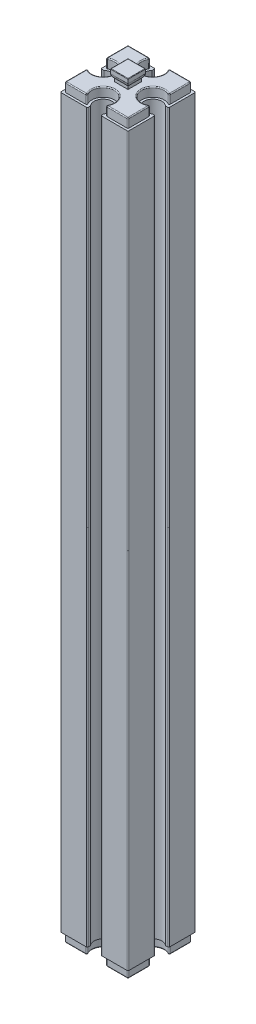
SolidWorks part; units mm, degrees
ref_plane "前视基准面" through (0, 0, 0) normal (0, 0, 1) x (1, 0, 0)
ref_plane "上视基准面" through (0, 0, 0) normal (0, 1, 0) x (1, 0, 0)
ref_plane "右视基准面" through (0, 0, 0) normal (1, 0, 0) x (0, 0, -1)
sketch "草图1" plane through (0, 0, 0) normal (0, 1, 0) x (1, 0, 0)
  line L0 (0, 0) -> (0, 7.5) construction
  line L1 (0, 0) -> (7.5, 0) construction
  line L2 (-7.5, 7.5) -> (-1.5, 7.5)
  line L3 (7.5, 7.5) -> (7.5, 1.5)
  line L4 (6.8229, 1.5) -> (7.5, 1.5)
  line L5 (6.8229, -1.5) -> (7.5, -1.5)
  line L6 (0, 7.5) -> (0, 5.5) construction
  line L7 (-1.5, 6.8229) -> (-1.5, 7.5)
  line L8 (1.5, 6.8229) -> (1.5, 7.5)
  line L9 (1.5, 7.5) -> (7.5, 7.5)
  line L10 (7.5, -1.5) -> (7.5, -7.5)
  line L11 (7.5, -7.5) -> (1.5, -7.5)
  line L12 (1.5, -6.8229) -> (1.5, -7.5)
  line L13 (-1.5, -6.8229) -> (-1.5, -7.5)
  line L14 (-1.5, -7.5) -> (-7.5, -7.5)
  line L15 (-7.5, -7.5) -> (-7.5, -1.5)
  line L16 (-6.8229, -1.5) -> (-7.5, -1.5)
  line L17 (-6.8229, 1.5) -> (-7.5, 1.5)
  line L18 (-7.5, 1.5) -> (-7.5, 7.5)
  arc A0 (-1.5, 6.8229) -> (1.5, 6.8229) centre (0, 5.5) ccw
  arc A1 (6.8229, 1.5) -> (6.8229, -1.5) centre (5.5, 0) ccw
  arc A2 (1.5, -6.8229) -> (-1.5, -6.8229) centre (0, -5.5) ccw
  arc A3 (-6.8229, -1.5) -> (-6.8229, 1.5) centre (-5.5, 0) ccw
  point P36 (0, 0)
  dimension "D6" = 4
  dimension "D7" = 2
  dimension "D1" = 7.5
  dimension "D2" = 7.5
  dimension "D3" = 2
  dimension "D4" = 7.5
  dimension "D5" = 1.5
extrude "凸台-拉伸1" add sketch "草图1" along normal blind 80.5
sketch "草图2" plane through (0, 80.5, 0) normal (0, 1, 0) x (1, 0, 0)
  line L0 (-7, 7) -> (-7, 2)
  line L1 (-7, 2) -> (-7, 2)
  line L2 (-7, -2) -> (-7, -2)
  line L3 (-7, -2) -> (-7, -7)
  line L4 (-7, -7) -> (-2, -7)
  line L5 (-2, -7) -> (-2, -7)
  line L6 (2, -7) -> (2, -7)
  line L7 (2, -7) -> (7, -7)
  line L8 (7, -7) -> (7, -2)
  line L9 (7, -2) -> (7, -2)
  line L10 (7, 2) -> (7, 2)
  line L11 (7, 2) -> (7, 7)
  line L12 (7, 7) -> (2, 7)
  line L13 (2, 7) -> (2, 7)
  line L14 (-2, 7) -> (-2, 7)
  line L15 (-2, 7) -> (-7, 7)
  line L16 (-7.5, 7.5) -> (-7.5, 1.5)
  line L17 (-7.5, 1.5) -> (-6.8229, 1.5)
  line L18 (-6.8229, -1.5) -> (-7.5, -1.5)
  line L19 (-7.5, -1.5) -> (-7.5, -7.5)
  line L20 (-7.5, -7.5) -> (-1.5, -7.5)
  line L21 (-1.5, -7.5) -> (-1.5, -6.8229)
  line L22 (1.5, -6.8229) -> (1.5, -7.5)
  line L23 (1.5, -7.5) -> (7.5, -7.5)
  line L24 (7.5, -7.5) -> (7.5, -1.5)
  line L25 (7.5, -1.5) -> (6.8229, -1.5)
  line L26 (6.8229, 1.5) -> (7.5, 1.5)
  line L27 (7.5, 1.5) -> (7.5, 7.5)
  line L28 (7.5, 7.5) -> (1.5, 7.5)
  line L29 (1.5, 7.5) -> (1.5, 6.8229)
  line L30 (-1.5, 6.8229) -> (-1.5, 7.5)
  line L31 (-1.5, 7.5) -> (-7.5, 7.5)
  line L32 (-7.5, 7.5) -> (-7.5, 1.5) construction
  line L33 (-7.5, 1.5) -> (-6.8229, 1.5) construction
  line L34 (-6.8229, -1.5) -> (-7.5, -1.5) construction
  line L35 (-7.5, -1.5) -> (-7.5, -7.5) construction
  line L36 (-7.5, -7.5) -> (-1.5, -7.5) construction
  line L37 (-1.5, -7.5) -> (-1.5, -6.8229) construction
  line L38 (1.5, -6.8229) -> (1.5, -7.5) construction
  line L39 (1.5, -7.5) -> (7.5, -7.5) construction
  line L40 (7.5, -7.5) -> (7.5, -1.5) construction
  line L41 (7.5, -1.5) -> (6.8229, -1.5) construction
  line L42 (6.8229, 1.5) -> (7.5, 1.5) construction
  line L43 (7.5, 1.5) -> (7.5, 7.5) construction
  line L44 (7.5, 7.5) -> (1.5, 7.5) construction
  line L45 (1.5, 7.5) -> (1.5, 6.8229) construction
  line L46 (-1.5, 6.8229) -> (-1.5, 7.5) construction
  line L47 (-1.5, 7.5) -> (-7.5, 7.5) construction
  arc A0 (-7, -2) -> (-7, 2) centre (-5.5, 0) ccw
  arc A1 (2, -7) -> (-2, -7) centre (0, -5.5) ccw
  arc A2 (7, 2) -> (7, -2) centre (5.5, 0) ccw
  arc A3 (-2, 7) -> (2, 7) centre (0, 5.5) ccw
  arc A4 (-6.8229, -1.5) -> (-6.8229, 1.5) centre (-5.5, 0) ccw
  arc A5 (1.5, -6.8229) -> (-1.5, -6.8229) centre (0, -5.5) ccw
  arc A6 (6.8229, 1.5) -> (6.8229, -1.5) centre (5.5, 0) ccw
  arc A7 (-1.5, 6.8229) -> (1.5, 6.8229) centre (0, 5.5) ccw
  arc A8 (-6.8229, -1.5) -> (-6.8229, 1.5) centre (-5.5, 0) ccw construction
  arc A9 (1.5, -6.8229) -> (-1.5, -6.8229) centre (0, -5.5) ccw construction
  arc A10 (6.8229, 1.5) -> (6.8229, -1.5) centre (5.5, 0) ccw construction
  arc A11 (-1.5, 6.8229) -> (1.5, 6.8229) centre (0, 5.5) ccw construction
  dimension "D1" = 0
  dimension "D2" = 0.5
extrude "凸台-拉伸2" add sketch "草图2" along normal blind 2
sketch "草图3" plane through (0, 0, 0) normal (1, 0, 0) x (0, 0, -1)
  line L0 (0, 82.5) -> (0, 84.5) construction
  line L1 (2.5, 82.5) -> (-2.5, 82.5) construction
  line L2 (0, 84.5) -> (0, 85) construction
  line L3 (-1.5, 82.5) -> (1.5, 82.5)
  line L4 (1.5, 82.5) -> (1.5, 83.1771)
  line L5 (-1.95, 85) -> (1.95, 85)
  line L6 (1.95, 85) -> (1.95, 84.0556)
  line L7 (-1.5, 82.5) -> (-1.5, 83.1771)
  line L8 (-1.95, 85) -> (-1.95, 84.0556)
  arc A0 (-1.5, 83.1771) -> (-1.95, 84.0556) centre (0, 84.5) cw
  arc A1 (1.5, 83.1771) -> (1.95, 84.0556) centre (0, 84.5) ccw
  dimension "D5" = 2
  dimension "D1" = 2
  dimension "D2" = 0.5
  dimension "D3" = 1.5
  dimension "D4" = 1.95
extrude "凸台-拉伸3" add sketch "草图3" along normal blind 2 and the other way blind 2
sketch "草图4" plane through (0, 0, 0) normal (0, 0, 1) x (1, 0, 0)
  line L0 (0, 82.5) -> (0, 84.5) construction
  line L2 (-2, 82.5) -> (2, 82.5) construction
  line L3 (0, 84.5) -> (0, 85) construction
  line L4 (-2, 85) -> (2, 85) construction
  line L5 (1.95, 85) -> (2, 85)
  line L6 (-1.95, 85) -> (-1.95, 84.0556)
  line L9 (-1.5, 82.5) -> (-1.5, 83.1771)
  line L10 (1.5, 82.5) -> (1.5, 83.1771)
  line L11 (1.95, 85) -> (1.95, 84.0556)
  line L12 (1.5, 82.5) -> (2, 82.5)
  line L13 (-2, 85) -> (-1.95, 85)
  line L14 (-2, 85) -> (-2, 82.5)
  line L15 (-2, 82.5) -> (-1.5, 82.5)
  line L16 (2, 85) -> (2, 82.5)
  arc A0 (-1.95, 84.0556) -> (-1.5, 83.1771) centre (0, 84.5) ccw
  arc A1 (1.95, 84.0556) -> (1.5, 83.1771) centre (0, 84.5) cw
  dimension "D1" = 2
  dimension "D2" = 1.5
  dimension "D3" = 1.95
fillet "圆角3" radius 0.2 13 edges at (-1.5, 40.25, -7.5) (1.5, 40.25, -7.5) (7.5, 40.25, -7.5) (7.5, 40.25, -1.5) (7.5, 40.25, 1.5) (7.5, 40.25, 7.5) (-1.5, 40.25, 7.5) (1.5, 40.25, 7.5) (-6.8229, 40.25, -1.5) (-7.5, 40.25, 7.5) (-7.5, 40.25, 1.5) (-7.5, 40.25, -1.5) (-7.5, 40.25, -7.5)
extrude "切除-拉伸1" cut sketch "草图4" against normal blind 3 and the other way blind 3
fillet "圆角4" radius 0.2 24 edges at (0, 82.5, 3) (-3, 82.5, 0) (0, 82.5, -3) (3, 82.5, 0) (7, 81.5, 2) (7, 81.5, -2) (2, 81.5, -7) (-2, 81.5, -7) (-7, 81.5, 2) (-7, 81.5, -2) (2, 81.5, 7) (-2, 81.5, 7) (7, 81.5, 7) (4.5, 82.5, 7) (7, 82.5, 4.5) (7, 82.5, -4.5) (7, 81.5, -7) (4.5, 82.5, -7) (-4.5, 82.5, -7) (-7, 81.5, -7) (-7, 82.5, -4.5) (-4.5, 82.5, 7) (-7, 82.5, 4.5) (-7, 81.5, 7)
fillet "圆角5" radius 0.1 4 edges at (0, 85, -1.95) (1.95, 85, 0) (0, 85, 1.95) (-1.95, 85, 0)
mirror "镜向1" of "圆角5", "圆角4", "切除-拉伸1", "圆角3", "凸台-拉伸3", "凸台-拉伸2", "凸台-拉伸1"
